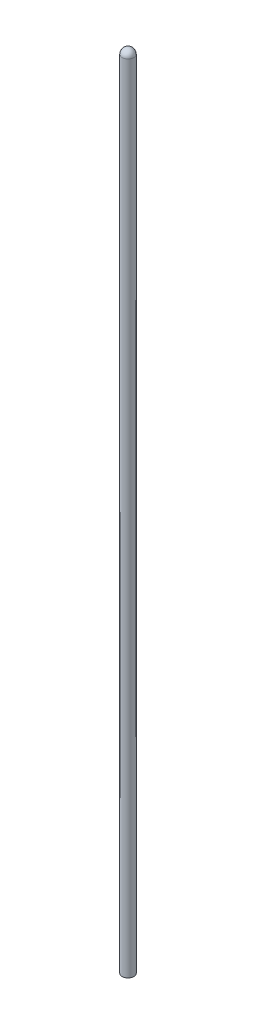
SolidWorks part; units mm, degrees
ref_plane "Front" through (0, 0, 0) normal (0, 0, 1) x (1, 0, 0)
ref_plane "Top" through (0, 0, 0) normal (0, 1, 0) x (1, 0, 0)
ref_plane "Right" through (0, 0, 0) normal (1, 0, 0) x (0, 0, -1)
sketch "Sketch1" plane through (0, 0, 0) normal (0, 1, 0) x (1, 0, 0)
  circle A0 centre (0, 0) radius 3.175
  dimension "D1" = 6.35
extrude "Base-Extrude" add sketch "Sketch1" along normal mid plane 431.8
dome "Dome1" faces to dome 1 distance 3.175 parameters "D1"=3.175
